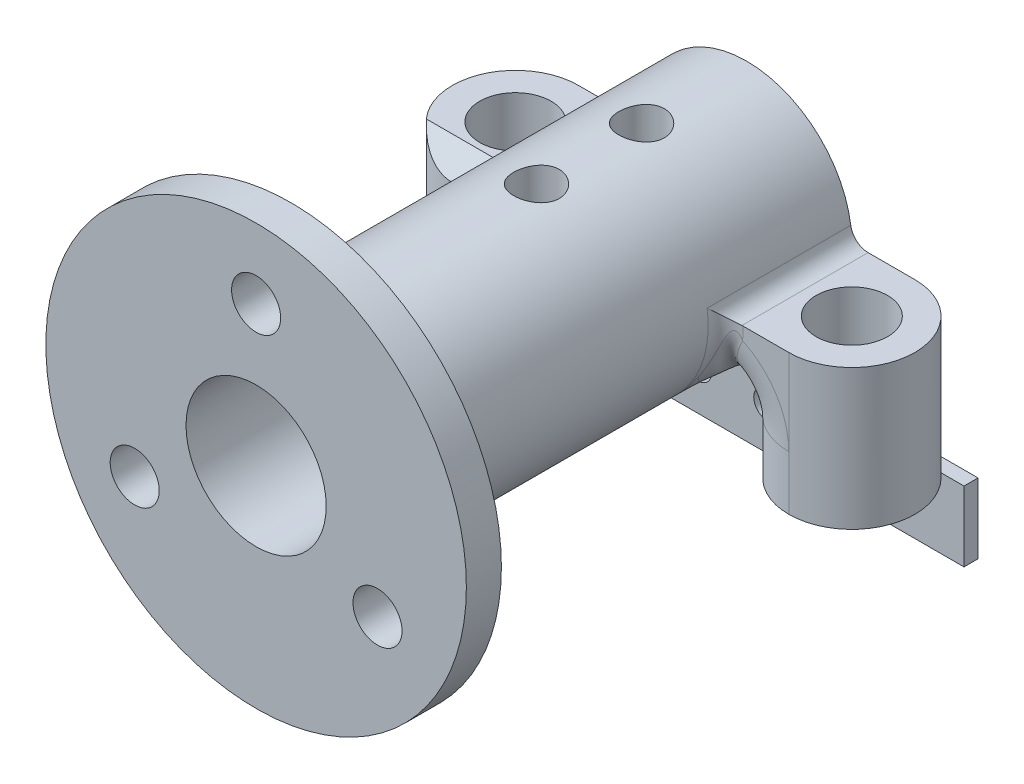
SolidWorks part; units mm, degrees
ref_plane "Plan de face" through (0, 0, 0) normal (0, 0, 1) x (1, 0, 0)
ref_plane "Plan de dessus" through (0, 0, 0) normal (0, 1, 0) x (1, 0, 0)
ref_plane "Plan de droite" through (0, 0, 0) normal (1, 0, 0) x (0, 0, -1)
sketch "Esquisse1" plane through (0, 0, 0) normal (0, 0, 1) x (1, 0, 0)
  circle A0 centre (0, 0) radius 30
  circle A1 centre (0, 0) radius 10
  dimension "D1" = 60
  dimension "D2" = 20
extrude "Boss.-Extru.1" add sketch "Esquisse1" along normal blind 5
sketch "Esquisse2" plane through (0, 0, 0) normal (0, 0, -1) x (-1, 0, 0)
  circle A0 centre (0, 0) radius 15
  circle A1 centre (0, 0) radius 10
  dimension "D1" = 30
  dimension "D2" = 20
extrude "Boss.-Extru.2" add sketch "Esquisse2" along normal blind 65
sketch "Esquisse3" plane through (0, 0, 5) normal (0, 0, 1) x (1, 0, 0)
  circle A0 centre (0, 20) radius 3.5
  dimension "D1" = 7
  dimension "D2" = 20
extrude "Enlèv. mat.-Extru.1" cut sketch "Esquisse3" against normal through all
pattern_circular "Répétition circulaire1" count 3 over 360 about axis through (0, 0, 0) along (0, 0, 1) of "Enlèv. mat.-Extru.1"
sketch "Esquisse5" plane through (0, 0, -65) normal (0, 0, -1) x (-1, 0, 0)
  line L0 (15, -30) -> (33, -30)
  line L1 (-33, -30) -> (-15, -30)
  line L2 (-33, -30) -> (-33, 0)
  line L3 (-33, 0) -> (-15, 0)
  line L4 (33, -30) -> (33, 0)
  line L5 (-15, 0) -> (-13, 0)
  line L6 (15, 0) -> (13, 0)
  line L7 (15, 0) -> (33, 0)
  line L8 (15, -12.2474) -> (15, -30)
  line L9 (-15, -12.2474) -> (-15, -30)
  circle A0 centre (0, 0) radius 15 construction
  circle A1 centre (0, 0) radius 15 construction
  arc A2 (-10.7143, -10.4978) -> (10.7143, -10.4978) centre (0, 0) ccw
  arc A3 (-10.7143, -10.4978) -> (-15, -12.2474) centre (-12.5, -12.2474) ccw
  arc A4 (15, -12.2474) -> (10.7143, -10.4978) centre (12.5, -12.2474) ccw
  arc A5 (-13, 0) -> (13, 0) centre (0, 0) ccw
  dimension "D4" = 2.5
  dimension "D1" = 33
  dimension "D2" = 33
  dimension "D3" = 30
extrude "Boss.-Extru.3" add sketch "Esquisse5" against normal blind 18
sketch "Esquisse6" plane through (0, 0, 0) normal (0, 1, 0) x (1, 0, 0)
  line L0 (-30, -5) -> (30, -5) construction
  line L1 (0, -5) -> (0, 65) construction
  circle A0 centre (24, 56) radius 5.1
  dimension "D3" = 10.2
  dimension "D1" = 61
  dimension "D2" = 24
extrude "Enlèv. mat.-Extru.13" cut sketch "Esquisse6" against normal through all
pattern_linear "Répétition linéaire4" count 2 spacing 48 along (-1, 0, 0) of "Enlèv. mat.-Extru.13"
sketch "Esquisse4" plane through (0, 0, 0) normal (0, 1, 0) x (1, 0, 0)
  line L0 (0, -5) -> (0, 65) construction
  line L1 (10, 65) -> (-10, 65) construction
  circle A0 centre (0, 50) radius 3.25
  dimension "D1" = 6.5
  dimension "D2" = 15
extrude "Enlèv. mat.-Extru.2" cut sketch "Esquisse4" along normal through all
pattern_linear "Répétition linéaire1" count 2 spacing 15 along (0, 0, 1) of "Enlèv. mat.-Extru.2"
sketch "Esquisse8" plane through (0, -30, 0) normal (0, -1, 0) x (1, 0, 0)
  line L1 (-33, -47) -> (-33, -65) construction
  line L2 (33, -47) -> (-33, -47)
  line L3 (33, -47) -> (33, -63)
  line L4 (33, -63) -> (-33, -63)
  line L6 (-33, -47) -> (-33, -63)
  line L7 (33, -65) -> (15, -65) construction
  dimension "D1" = 2
sketch "Esquisse9" plane through (0, 0, -65) normal (0, 0, -1) x (-1, 0, 0)
  line L0 (-33, -30) -> (-15, -30) construction
  circle A0 centre (5, -24) radius 2
  dimension "D3" = 4
  dimension "D1" = 5
  dimension "D2" = 6
extrude "Enlèv. mat.-Extru.14" cut sketch "Esquisse8" against normal blind 10
sketch "Esquisse13" plane through (0, -30, 0) normal (0, -1, 0) x (1, 0, 0)
  line L1 (15, -65) -> (-15, -65)
  line L2 (15, -65) -> (15, -63)
  line L3 (15, -63) -> (-15, -63)
  line L4 (-15, -65) -> (-15, -63)
extrude "Boss.-Extru.6" add sketch "Esquisse13" against normal up to body
extrude "Enlèv. mat.-Extru.6" cut sketch "Esquisse9" against normal up to next
pattern_linear "Répétition linéaire3" count 2 spacing 10 along (1, 0, 0) of "Enlèv. mat.-Extru.6"
sketch "Esquisse10" plane through (0, 0, 0) normal (0, 1, 0) x (1, 0, 0)
  line L0 (0, -5) -> (0, 65) construction
  circle A0 centre (0, 50) radius 5.25
  circle A1 centre (0, 35) radius 5.25
  circle A2 centre (0, 35) radius 3.25 construction
  circle A3 centre (0, 50) radius 3.25 construction
  dimension "D1" = 10.5
  dimension "D2" = 10.5
extrude "Enlèv. mat.-Extru.7" cut sketch "Esquisse10" against normal through all
sketch "Esquisse14" plane through (0, 0, 0) normal (0, 1, 0) x (1, 0, 0)
  line L0 (15, 47) -> (33, 47) construction
  line L1 (15, 65) -> (33, 65) construction
  line L2 (24, 65) -> (24, 69.8171)
  line L3 (24, 69.8171) -> (38.4497, 69.8171)
  line L4 (38.4497, 69.8171) -> (38.4497, 43.045)
  line L5 (38.4497, 43.045) -> (24, 43.045)
  line L6 (24, 43.045) -> (24, 47)
  arc A0 (24, 47) -> (24, 65) centre (24, 56) ccw
extrude "Enlèv. mat.-Extru.15" cut sketch "Esquisse14" against normal up to vertex
sketch "Esquisse15" plane through (0, 0, 0) normal (0, 1, 0) x (1, 0, 0)
  line L0 (-33, 47) -> (-15, 47) construction
  line L1 (-33, 65) -> (-15, 65) construction
  line L2 (-24, 47) -> (-38.5379, 47)
  line L3 (-38.5379, 47) -> (-38.5379, 65)
  line L4 (-38.5379, 65) -> (-24, 65)
  arc A0 (-24, 47) -> (-24, 65) centre (-24, 56) cw
extrude "Enlèv. mat.-Extru.16" cut sketch "Esquisse15" against normal up to surface (20 mm away)
fillet "Congé7" radius 2.5 5 edges at (15, -16.1237, -63) (13.4449, -9.9329, -63) (-15, -16.1237, -63) (-13.4449, -9.9329, -63) (0, -15, -63)
fillet "Congé9" radius 2.5 1 edges at (15, 0, -56)
fillet "Congé13" radius 2.5 1 edges at (-15, 0, -56)
fillet "Congé14" radius 2.5 1 edges at (-14.2577, -4.6604, -47)
fillet "Congé15" radius 9 3 edges at (-12.9944, -9.7968, -46.6786) (-14.7687, -11.1972, -47) (-15, -16.1237, -47)
fillet "Congé16" radius 2.5 1 edges at (14.2577, -4.6604, -47)
fillet "Congé17" radius 9 3 edges at (12.9944, -9.7968, -46.6786) (14.7687, -11.1972, -47) (15, -16.1237, -47)
chamfer "Chanfrein3" distance 3 angle 45 1 edges at (-20.75, 0, -47)
sketch "Esquisse11" plane through (0, 0, 0) normal (1, 0, 0) x (0, 0, -1)
  line L0 (50, 15) -> (50, 10) construction
  line L1 (-5, 0) -> (65, 0) construction
  circle A0 centre (42.5, 0) radius 5.25
  dimension "D1" = 10.5
  dimension "D2" = 7.5
extrude "Enlèv. mat.-Extru.8" cut sketch "Esquisse11" against normal through all
